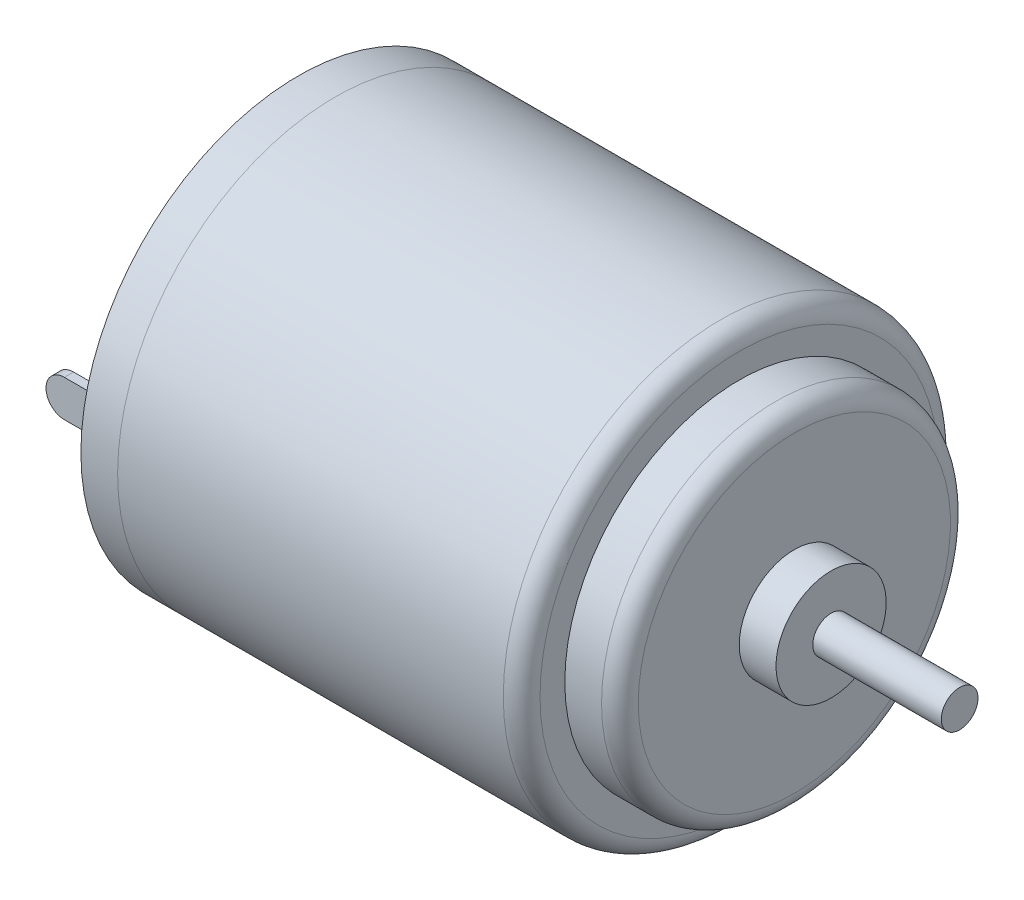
SolidWorks part; units mm, degrees
ref_plane "正面" through (0, 0, 0) normal (0, 0, 1) x (1, 0, 0)
ref_plane "平面" through (0, 0, 0) normal (0, 1, 0) x (1, 0, 0)
ref_plane "右側面" through (0, 0, 0) normal (1, 0, 0) x (0, 0, -1)
sketch "ｽｹｯﾁ1" plane through (0, 0, 0) normal (0, 0, 1) x (1, 0, 0)
  line L0 (0, 0) -> (27, 0)
  line L1 (27, 0) -> (27, 3)
  line L2 (27, 3) -> (25, 3)
  line L3 (25, 3) -> (25, 9.5)
  line L4 (25, 9.5) -> (22, 9.5)
  line L5 (22, 9.5) -> (22, 11.85)
  line L6 (22, 11.85) -> (0, 11.85)
  line L7 (0, 11.85) -> (0, 0)
  dimension "D1" = 3
  dimension "D2" = 2
  dimension "D3" = 22
  dimension "D4" = 25
  dimension "D5" = 11.85
  dimension "D6" = 9.5
revolve "回転1" add sketch "ｽｹｯﾁ1" angle 360 about L0
sketch "ｽｹｯﾁ2" plane through (0, 0, 0) normal (0, 0, 1) x (1, 0, 0)
  line L0 (0, 0) -> (0, 11.85)
  line L1 (0, 11.85) -> (0, -11.85) construction
  line L2 (0, 11.85) -> (-2, 11.85)
  line L3 (-2, 11.85) -> (-2, 4.25)
  line L4 (-2, 4.25) -> (-4, 4.25)
  line L5 (-4, 4.25) -> (-4, 0)
  line L6 (-4, 0) -> (0, 0)
  dimension "D1" = 2
  dimension "D2" = 2
  dimension "D3" = 4.25
revolve "回転2" add sketch "ｽｹｯﾁ2" angle 360 about L6
sketch "ｽｹｯﾁ3" plane through (27, 0, 0) normal (1, 0, 0) x (0, 0, -1)
  circle A0 centre (0, 0) radius 1
  dimension "D1" = 2
extrude "押し出し1" add sketch "ｽｹｯﾁ3" along normal blind 7 and the other way blind 32 separate body
ref_plane "平面1" through (0, 0, 9.25) normal (0, 0, 1) x (1, 0, 0)
sketch "ｽｹｯﾁ5" plane through (0, 0, 9.25) normal (0, 0, 1) x (1, 0, 0)
  line L0 (-2, 11.85) -> (-2, -11.85) construction
  line L1 (-2, -1) -> (-5, -1)
  line L2 (-2, -1) -> (-2, 1)
  line L3 (-2, 1) -> (-5, 1)
  arc A0 (-5, 1) -> (-5, -1) centre (-5, 0) ccw
  dimension "D1" = 3
  dimension "D2" = 2
  dimension "D3" = 1
extrude "押し出し2" add sketch "ｽｹｯﾁ5" along normal blind 0.5
mirror "ﾐﾗｰ1" about plane through (0, 0, 0) normal (0, 0, 1) of "押し出し2"
fillet "ﾌｨﾚｯﾄ1" radius 1 2 edges at (22, 0, 11.85) (25, 0, 9.5)
